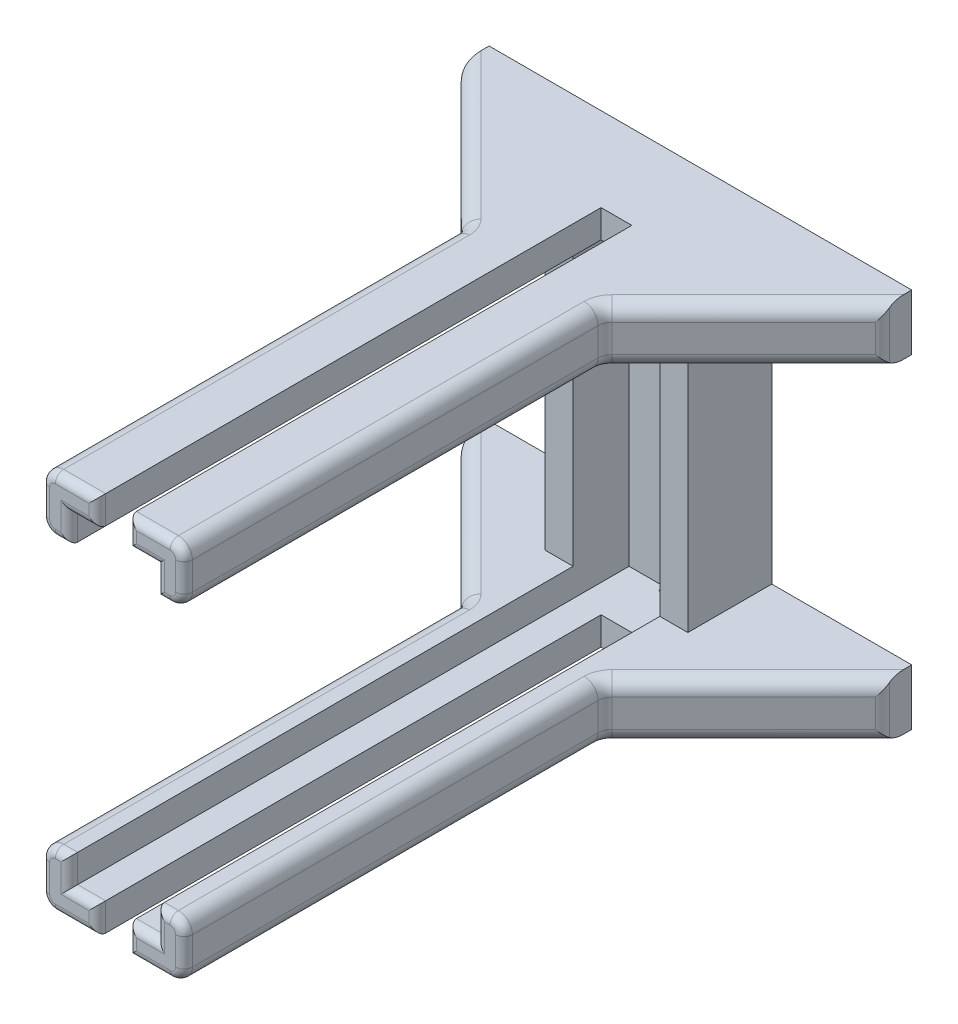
SolidWorks part; units mm, degrees
ref_plane "Front Plane" through (0, 0, 0) normal (1, 0, 0) x (0, 1, 0)
ref_plane "Top Plane" through (0, 0, 0) normal (0, 0, 1) x (0, 1, 0)
ref_plane "Right Plane" through (0, 0, 0) normal (0, 1, 0) x (-1, 0, 0)
sketch "Sketch3" plane through (0, 0, 0) normal (0, 0, 1) x (0, 1, 0)
  line L1 (-58, -15.5) -> (58, -15.5)
  line L2 (-58, -15.5) -> (-58, 15.5)
  line L3 (-58, 15.5) -> (58, 15.5)
  line L4 (58, -15.5) -> (58, 15.5)
  line L5 (-58, -15.5) -> (58, 15.5) construction
  line L6 (-58, 15.5) -> (58, -15.5) construction
  line L7 (-68, -25.5) -> (68, -25.5)
  line L8 (-68, -25.5) -> (-68, 25.5)
  line L9 (-68, 25.5) -> (68, 25.5)
  line L10 (68, -25.5) -> (68, 25.5)
  line L11 (-68, -25.5) -> (68, 25.5) construction
  line L12 (-68, 25.5) -> (68, -25.5) construction
  point P0 (0, 0)
  point P6 (0, 0)
  point P11 (0, 0)
  point P12 (0, 0)
  dimension "D1" = 116
  dimension "D2" = 31
  dimension "D3" = 10
  dimension "D4" = 10
extrude "Boss-Extrude2" add sketch "Sketch3" along normal blind 30
sketch "Sketch4" plane through (0, 0, 0) normal (0, 0, 1) x (0, 1, 0)
  line L1 (-58, -15.5) -> (58, -15.5)
  line L2 (-58, -15.5) -> (-58, 15.5)
  line L3 (-58, 15.5) -> (58, 15.5)
  line L4 (58, -15.5) -> (58, 15.5)
  line L5 (-58, -15.5) -> (58, 15.5) construction
  line L6 (-58, 15.5) -> (58, -15.5) construction
  point P0 (0, 0)
  dimension "D1" = 116
  dimension "D2" = 31
extrude "Boss-Extrude3" add sketch "Sketch4" along normal blind 10
sketch "Sketch5" plane through (0, 0, 0) normal (0, 0, -1) x (1, 0, 0)
  line L0 (0, 0) -> (0, 68) construction
  line L1 (-25.5, 68) -> (25.5, 68) construction
  line L2 (0, 0) -> (0, -68) construction
  line L3 (25.5, -68) -> (-25.5, -68) construction
  line L4 (-25.5, -58) -> (0, -58) construction
  line L5 (-25.5, -68) -> (-25.5, 68) construction
  line L6 (0, -58) -> (25.5, -58) construction
  line L7 (25.5, 68) -> (25.5, -68) construction
  line L8 (-25.5, 58) -> (0, 58) construction
  line L9 (0, 58) -> (25.5, 58) construction
  line L10 (-15.5, -68) -> (-15.5, -58) construction
  line L11 (15.5, -68) -> (15.5, -58) construction
  line L12 (-15.5, 68) -> (-15.5, 58) construction
  line L13 (15.5, 68) -> (15.5, 58) construction
  dimension "D1" = 10
  dimension "D2" = 10
  dimension "D3" = 10
  dimension "D4" = 10
  dimension "D5" = 10
  dimension "D6" = 10
sketch "Sketch6" plane through (0, 0, 30) normal (0, 0, 1) x (1, 0, 0)
  line L0 (-25.5, -48) -> (-15.5, -48)
  line L1 (-25.5, 68) -> (-25.5, -68) construction
  line L2 (-15.5, 58) -> (-15.5, -58) construction
  line L3 (-25.5, -48) -> (-25.5, -68)
  line L4 (-25.5, -68) -> (-5.5, -68)
  line L5 (-25.5, -68) -> (25.5, -68) construction
  line L6 (-5.5, -68) -> (-5.5, -58)
  line L7 (-25.5, -58) -> (0, -58) construction
  line L8 (-5.5, -58) -> (-15.5, -58)
  line L9 (-15.5, -58) -> (-15.5, -48)
  line L10 (0, -68) -> (0, 68) construction
  line L11 (5.5, -58) -> (15.5, -58)
  line L12 (5.5, -68) -> (5.5, -58)
  line L13 (25.5, -68) -> (5.5, -68)
  line L14 (25.5, -48) -> (25.5, -68)
  line L15 (25.5, -48) -> (15.5, -48)
  line L16 (15.5, -58) -> (15.5, -48)
  line L17 (-25.5, 0) -> (25.5, 0) construction
  line L18 (25.5, -68) -> (25.5, 68) construction
  line L19 (5.5, 68) -> (5.5, 58)
  line L20 (25.5, 68) -> (5.5, 68)
  line L21 (25.5, 48) -> (25.5, 68)
  line L22 (25.5, 48) -> (15.5, 48)
  line L23 (15.5, 58) -> (15.5, 48)
  line L24 (5.5, 58) -> (15.5, 58)
  line L25 (-5.5, 58) -> (-15.5, 58)
  line L26 (-5.5, 68) -> (-5.5, 58)
  line L27 (-25.5, 68) -> (-5.5, 68)
  line L28 (-25.5, 48) -> (-25.5, 68)
  line L29 (-25.5, 48) -> (-15.5, 48)
  line L30 (-15.5, 58) -> (-15.5, 48)
  dimension "D1" = 20
  dimension "D2" = 20
extrude "Boss-Extrude4" add sketch "Sketch6" along normal blind 180
sketch "Sketch7" plane through (25.5, 0, 0) normal (1, 0, 0) x (0, 1, 0)
  line L0 (-68, 60) -> (-48, 60)
  line L1 (-68, 210) -> (-68, 0) construction
  line L2 (-48, 210) -> (-48, 30) construction
  line L3 (48, 60) -> (68, 60)
  line L4 (48, 210) -> (48, 30) construction
  line L5 (68, 210) -> (68, 0) construction
  line L6 (-68, 60) -> (-68, 0)
  line L7 (-68, 0) -> (-48, 0)
  line L8 (0, 0) -> (-68, 0) construction
  line L9 (-48, 0) -> (-48, 30)
  line L10 (-48, 30) -> (-48, 60)
  line L11 (48, 60) -> (48, 30)
  line L12 (48, 30) -> (48, 0)
  line L13 (0, 0) -> (68, 0) construction
  line L14 (48, 0) -> (68, 0)
  line L15 (68, 0) -> (68, 60)
  dimension "D1" = 60
extrude "Boss-Extrude5" add sketch "Sketch7" along normal blind 50
chamfer "Chamfer1" distance 50 angle 45 2 edges at (75.5, 58, 60) (75.5, -58, 60)
mirror "Mirror1" about plane through (0, 0, 0) normal (1, 0, 0) of "Boss-Extrude5", "Chamfer1"
fillet "Fillet2" radius 5 12 edges at (25.5, -58, 60) (25.5, 58, 60) (75.5, 58, 10) (50.5, 48, 35) (50.5, 68, 35) (75.5, -58, 10) (50.5, -68, 35) (50.5, -48, 35) (25.5, 48, 135) (25.5, -48, 135) (25.5, 68, 135) (25.5, -68, 135)
fillet "Fillet3" radius 3 8 edges at (5.5, -63, 210) (10.5, -58, 210) (15.5, -53, 210) (18, -48, 210) (24.0355, -49.4645, 210) (25.5, -58, 210) (24.0355, -66.5355, 210) (13, -68, 210)
fillet "Fillet4" radius 3 8 edges at (13, 68, 210) (25.5, 58, 210) (24.0355, 49.4645, 210) (24.0355, 66.5355, 210) (5.5, 63, 210) (10.5, 58, 210) (15.5, 53, 210) (18, 48, 210)
fillet "Fillet5" radius 5 12 edges at (-25.5, -58, 60) (-25.5, 58, 60) (-50.5, 48, 35) (-75.5, 58, 10) (-50.5, 68, 35) (-50.5, -68, 35) (-75.5, -58, 10) (-50.5, -48, 35) (-25.5, 48, 135) (-25.5, -48, 135) (-25.5, -68, 135) (-25.5, 68, 135)
fillet "Fillet6" radius 3 16 edges at (-5.5, 63, 210) (-10.5, 58, 210) (-15.5, 53, 210) (-18, 48, 210) (-24.0355, 49.4645, 210) (-25.5, 58, 210) (-24.0355, 66.5355, 210) (-13, 68, 210) (-15.5, -53, 210) (-10.5, -58, 210) (-5.5, -63, 210) (-13, -68, 210) (-24.0355, -66.5355, 210) (-25.5, -58, 210) (-24.0355, -49.4645, 210) (-18, -48, 210)
sketch "Sketch10" plane through (0, 0, 0) normal (0, 0, -1) x (1, 0, 0)
  line L0 (-75.5, 58) -> (75.5, 58) construction
  line L1 (-75.5, 68) -> (-75.5, 48) construction
  line L2 (75.5, 68) -> (75.5, 48) construction
  line L3 (-75.5, -58) -> (75.5, -58) construction
  line L4 (-75.5, -48) -> (-75.5, -68) construction
  line L5 (75.5, -48) -> (75.5, -68) construction
  line L6 (-60.5, 68) -> (-60.5, 48) construction
  line L7 (-75.5, 68) -> (75.5, 68) construction
  line L8 (-75.5, 48) -> (-25.5, 48) construction
  line L9 (-45.5, 68) -> (-45.5, 48) construction
  line L10 (0, 68) -> (0, -68) construction
  line L12 (75.5, -68) -> (-75.5, -68) construction
  line L13 (-25.5, 0) -> (25.5, 0) construction
  line L14 (-25.5, -48) -> (-25.5, 48) construction
  line L15 (25.5, 48) -> (25.5, -48) construction
  line L16 (45.5, 68) -> (45.5, 48) construction
  line L17 (60.5, 68) -> (60.5, 48) construction
  line L18 (60.5, -68) -> (60.5, -48) construction
  line L19 (45.5, -68) -> (45.5, -48) construction
  line L20 (-45.5, -68) -> (-45.5, -48) construction
  line L21 (-60.5, -68) -> (-60.5, -48) construction
  point P43 (-60.5, 58)
  point P45 (-45.5, 58)
  point P47 (0, 58)
  point P49 (45.5, 58)
  point P51 (60.5, 58)
  point P53 (60.5, -58)
  point P55 (45.5, -58)
  point P57 (-45.5, -58)
  point P59 (-60.5, -58)
  dimension "D1" = 15
  dimension "D2" = 15
hole_wizard "CSK for M5 Flat Head Machine Screw1" positions "Sketch10" profile "Sketch12" countersink size "M5" standard "ANSI Metric"
sketch "Sketch12" plane through (-60.5, 58, 0) normal (1, 0, 0) x (0, 1, 0)
  line L0 (0, 0) -> (0, 13.6524)
  line L1 (0, 13.6524) -> (2.75, 12)
  line L2 (2.75, 12) -> (2.75, 2.45)
  line L3 (2.75, 2.45) -> (5.2, 0)
  line L5 (5.2, 0) -> (0, 0)
  line L6 (-2.75, 2.45) -> (-5.2, 0) construction
  line L10 (0, 13.6524) -> (-2.75, 12) construction
  line L11 (0, -6.35) -> (0, 107.95) construction
  dimension "Hole Dia." = 5.5
  dimension "Hole Depth" = 12
  dimension "Near C'Sink Dia." = 10.4
  dimension "Near C'Sink Angle" = 90
  dimension "Drill Angle" = 118
